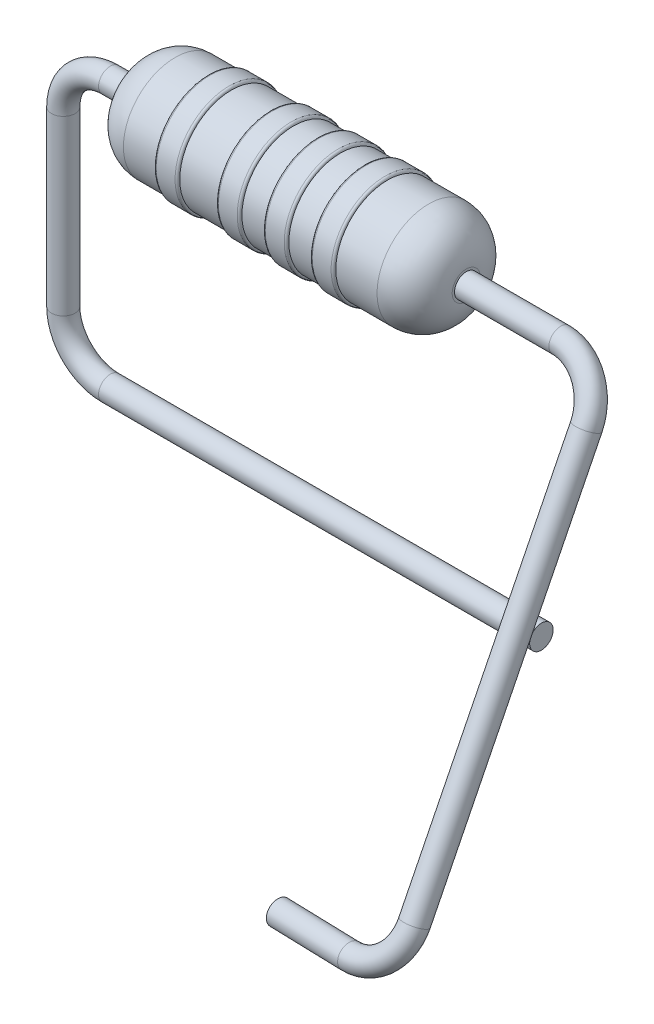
SolidWorks part; units mm, degrees
ref_plane "Face" through (0, 0, 0) normal (0, 0, 1) x (1, 0, 0)
ref_plane "Dessus" through (0, 0, 0) normal (0, 1, 0) x (1, 0, 0)
ref_plane "Droite" through (0, 0, 0) normal (1, 0, 0) x (0, 0, -1)
sketch "Esquisse1" plane through (0, 0, 0) normal (0, 0, 1) x (1, 0, 0)
  line L0 (-54.2687, 0) -> (62.1733, 0) construction
  line L1 (-48.4922, 1.1) -> (45.7559, 1.1) construction
  line L2 (-3.5, -1.6411) -> (-3.5, 4.3175) construction
  line L3 (0, -1.0268) -> (0, 4.1947) construction
  line L4 (3.5, 3.6009) -> (3.5, -1.9687) construction
  line L5 (-3.5, 0) -> (-3.5, 0.3)
  line L6 (-2.7, 1.1) -> (2.7, 1.1)
  line L7 (3.5, 0.3) -> (3.5, 0)
  line L8 (3.5, 0) -> (-3.5, 0)
  arc A0 (-2.7, 1.1) -> (-3.5, 0.3) centre (-2.7, 0.3) ccw
  arc A1 (3.5, 0.3) -> (2.7, 1.1) centre (2.7, 0.3) ccw
revolve "Base-Révolution" add sketch "Esquisse1" angle 360 about L0
sketch "Esquisse2" plane through (0, 0, 0) normal (0, 0, 1) x (1, 0, 0)
  line L0 (-3.3896, 1.15) -> (3.161, 1.15) construction
  line L1 (-2, 1.3889) -> (-2, -0.1179) construction
  line L2 (-1.5, 1.4925) -> (-1.5, -0.2136) construction
  line L3 (4.3262, 0) -> (-3.8651, 0) construction
  line L4 (1.323, 0) -> (1.823, 0)
  line L5 (0.323, 0) -> (0.823, 0)
  line L6 (-0.677, 1.15) -> (-0.677, 0)
  line L7 (0.323, 1.15) -> (0.323, 0)
  line L8 (1.323, 1.15) -> (1.323, 0)
  line L9 (-0.177, 1.15) -> (-0.177, 0)
  line L10 (0.823, 1.15) -> (0.823, 0)
  line L11 (1.823, 1.15) -> (1.823, 0)
  line L12 (-0.677, 0) -> (-0.177, 0)
  line L13 (-0.677, 1.15) -> (-0.177, 1.15)
  line L14 (0.323, 1.15) -> (0.823, 1.15)
  line L15 (1.323, 1.15) -> (1.823, 1.15)
  line L16 (-2, 1.15) -> (-1.5, 1.15)
  line L17 (-1.5, 1.15) -> (-1.5, 0)
  line L18 (-1.5, 0) -> (-2, 0)
  line L19 (-2, 0) -> (-2, 1.15)
revolve "Boss.-Révol.1" add sketch "Esquisse2" angle 360 about L3
fillet "Congé1" radius 0.05 8 edges at (-0.177, 0, -1.15) (-0.677, 0, -1.15) (0.823, 0, -1.15) (0.323, 0, -1.15) (1.823, 0, -1.15) (1.323, 0, -1.15) (-1.5, 0, -1.15) (-2, 0, -1.15)
sketch "Esquisse3" plane through (-3.5, 0, 0) normal (-1, 0, 0) x (0, 0, 1)
  circle A0 centre (0, 0) radius 0.25
sketch "Esquisse4" plane through (0, 0, 0) normal (0, 0, 1) x (1, 0, 0)
  line L0 (-3.1075, 0) -> (-5.8186, 0) construction
  line L1 (0, -2.524) -> (0, 3.2043) construction
  line L2 (-5.9326, -5.68) -> (7.6536, -5.68) construction
  line L3 (-5.08, 1.6795) -> (-5.08, -6.3739) construction
  line L4 (-3.5, 0) -> (-4.08, 0)
  line L5 (3.5, -0.8657) -> (3.5, -3.4091) construction
  line L6 (5.1, -0.8657) -> (5.1, -6.2296) construction
  line L7 (-5.08, -1) -> (-5.08, -4.68)
  line L8 (-4.08, -5.68) -> (5.1, -5.68)
  arc A0 (-5.08, -1) -> (-4.08, 0) centre (-4.08, -1) cw
  arc A1 (-5.08, -4.68) -> (-4.08, -5.68) centre (-4.08, -4.68) ccw
  dimension "D1" = 5.68
  dimension "D2" = 5.08
  dimension "D4" = 1.6
sweep "Balayage1" add profiles "Esquisse3" path "Esquisse4"
ref_plane "Plan1" through (0, 0, 0) normal (1, 0, 0) x (0, 0, -1)
sketch "Esquisse5" plane through (3.5, 0, 0) normal (1, 0, 0) x (0, 0, -1)
  circle A0 centre (0, 0) radius 0.25
extrude "Extrusion1" add sketch "Esquisse5" along normal blind 2
sketch3d "Esquisse3D1"
  line L0 (5.5, 0, 0) -> (5.5, -9.1157, 4.4867) construction
  line L1 (5.5, 0, 0) -> (3.5, 0, 0) construction
  line L2 (5.1, -5.68, 0) -> (5.1, 3.6404, -4.5875) construction
  line L3 (-4.08, -5.68, 0) -> (5.1, -5.68, 0) construction
  line L4 (5.5, 0, 0) -> (5.51, 0, 0)
  line L5 (6.5, -0.8855, 0.4427) -> (6.5, -8.2019, 4.1006)
  line L6 (5.5118, -9.1153, 4.4874) -> (5.5, -9.1157, 4.4867)
  arc A1 (6.5, -8.2019, 4.1006) -> (5.5118, -9.1153, 4.4874) centre (5.512, -8.2298, 4.0447) ccw
  arc A2 (5.51, 0, 0) -> (6.5, -0.8855, 0.4427) centre (5.51, -0.8855, 0.4427) ccw
  point P12 (6.5, -9.0875, 4.5434)
  point P13 (5.5745, -8.6717, 3.1609)
  point P16 (6.5, 0, 0)
  point P17 (5.51, -1.3282, -0.4428)
  dimension "D1" = 2.54
  dimension "D2" = 10.16
sketch "Esquisse6" plane through (5.5, 0, 0) normal (1, 0, 0) x (0, 0, -1)
  circle A0 centre (0, 0) radius 0.25
sweep "Balayage2" add profiles "Esquisse6" path "Esquisse3D1"
sketch "Esquisse7" plane through (5.4761, 0.154, 0.3104) normal (-0.998, -0.0281, -0.0566) x (-0.0566, -0.0016, 0.9984)
  circle A0 centre (4.1829, -9.2667) radius 0.25
extrude "Boss.-Extru.1" add sketch "Esquisse7" along normal blind 1.6
